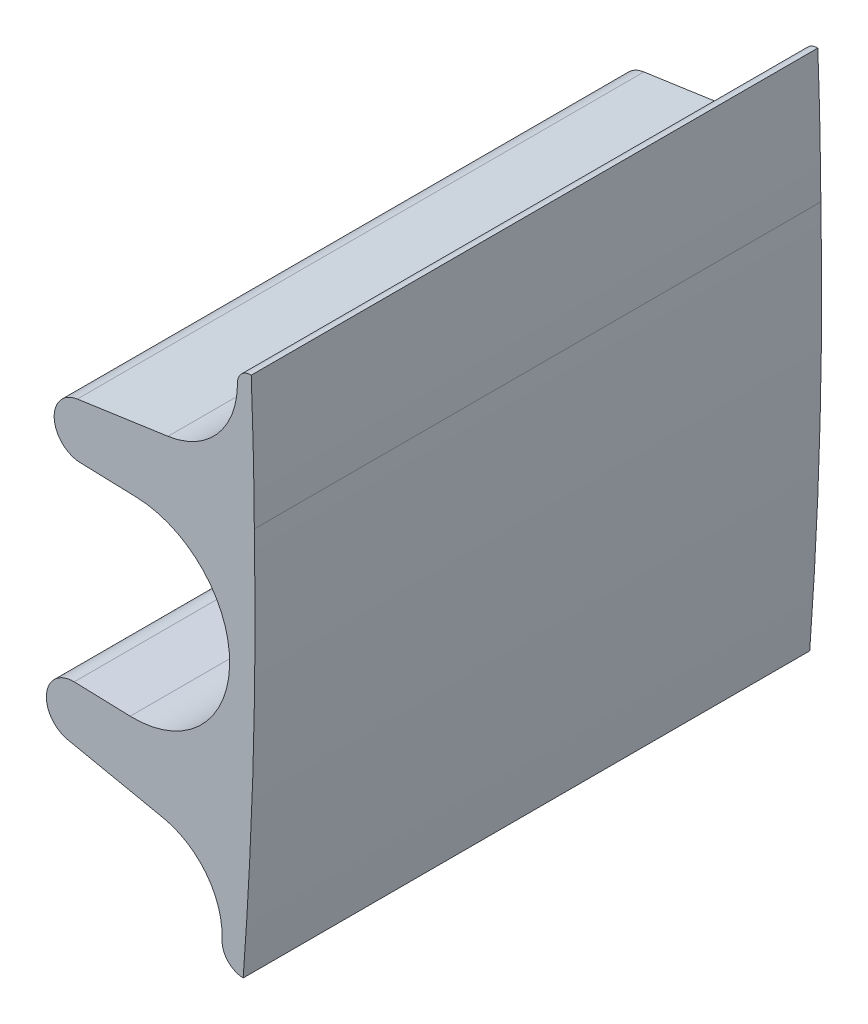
SolidWorks part; units mm, degrees
ref_plane "Plan de face" through (0, 0, 0) normal (0, 0, 1) x (1, 0, 0)
ref_plane "Plan de dessus" through (0, 0, 0) normal (0, 1, 0) x (1, 0, 0)
ref_plane "Plan de droite" through (0, 0, 0) normal (1, 0, 0) x (0, 0, -1)
sketch "Esquisse1" plane through (0, 0, 22.2) normal (0, 0, 1) x (1, 0, 0)
  line L0 (100.5809, 22.6603) -> (98.8108, -33.466) construction
  line L1 (90.1745, 11.994) -> (89.418, -11.994) construction
  line L2 (89.7962, 0) -> (99.8562, -0.3173) construction
  line L3 (85.6517, 11.2559) -> (92.3747, 12.2239)
  line L4 (83.0445, 12.7411) -> (82.4587, -5.8331) construction
  line L5 (89.5708, -7.1464) -> (85.4229, -7.0156)
  line L6 (84.044, 12.7096) -> (83.4582, -5.8646) construction
  line L7 (85.9367, 9.2763) -> (97.9424, 9.9462) construction
  line L8 (85.8737, 7.2773) -> (90.0216, 7.1464)
  line L9 (85.3599, -9.0146) -> (97.5096, -10.4648) construction
  line L10 (84.9507, -10.9723) -> (92.01, -12.4479)
  line L11 (97.6632, 22.6212) -> (96.4767, -15.0006) construction
  line L12 (90.8416, -19.5427) -> (101.6226, -19.8827) construction
  line L13 (93.7751, 19.3842) -> (104.5196, 19.0454) construction
  line L14 (98.5136, 18.2464) -> (98.5656, 19.8956) construction
  line L15 (97.5262, 18.2775) -> (97.5166, 17.9735)
  line L16 (97.9986, -18.1472) -> (97.9476, -19.7668) construction
  line L17 (96.382, -18.0049) -> (96.3791, -18.0961)
  arc A0 (93.4921, -11.4167) -> (87.0968, 11.6924) centre (89.7962, 0) ccw construction
  arc A1 (85.7612, -5.9027) -> (85.6383, -5.8167) centre (89.7962, 0) ccw construction
  arc A2 (89.5708, -7.1464) -> (90.0216, 7.1464) centre (89.7962, 0) ccw
  arc A3 (85.6517, 11.2559) -> (85.8737, 7.2773) centre (85.9367, 9.2763) ccw
  arc A4 (85.4229, -7.0156) -> (84.9507, -10.9723) centre (85.3599, -9.0146) ccw
  arc A5 (92.3747, 12.2239) -> (97.5166, 17.9735) centre (91.5196, 18.1626) ccw
  arc A6 (98.5447, 19.2338) -> (97.5262, 18.2775) centre (98.5136, 18.2464) ccw
  arc A7 (96.382, -18.0049) -> (92.01, -12.4479) centre (90.8847, -17.8316) ccw
  arc A8 (96.3791, -18.0961) -> (97.9476, -19.7668) centre (97.9986, -18.1472) ccw
  spline S0 degree 3 poles (45.0889, -203.3525) (78.8375, -132.8381) (101.1087, -58.3676) (99.7734, 9.4892) knots 0 0 0 0 1 1 1 1 construction
  spline S5 degree 3 poles (-1523.8995, -1118.3395) (-8.8803, -446.6828) (140.7725, -157.8905) (25.9108, 386.013) (-380.0031, 603.4365) (1484.801, 1449.7342) knots -4.803012 -4.803012 -4.803012 -4.803012 0.5 0.5 7.431861 7.431861 7.431861 7.431861 only from (98.7734, 9.4819) to (72.5655, 143.3925)
  spline S6 degree 3 poles (98.7735, 9.4757) (98.7497, 12.7427) (98.6726, 15.9951) (98.5447, 19.2338) knots -0.000044 -0.000044 -0.000044 -0.000044 0.069622 0.069622 0.069622 0.069622
  spline S7 degree 3 poles (1017.5257, 1528.9347) (-972.0485, -1126.3774) (-44.8972, -579.2317) (171.3603, 228.1602) (-99.7079, 523.4008) (-1834.3954, -190.6439) knots -6.245628 -6.245628 -6.245628 -6.245628 0.5 0.5 5.017541 5.017541 5.017541 5.017541 only from (44.1869, -202.9208) to (98.7736, 9.4695)
  spline S8 degree 3 poles (97.9476, -19.7668) (98.6762, -9.9037) (98.963, -0.1459) (98.7735, 9.4757) knots 0.857747 0.857747 0.857747 0.857747 1.000031 1.000031 1.000031 1.000031
  point P51 (97.9476, -19.7668)
  dimension "D2" = 1
  dimension "D1" = 10.06
  dimension "D3" = 4
  dimension "D5" = 5
  dimension "D10" = 12
  dimension "D11" = 11
  dimension "D4" = 5
  dimension "D6" = 1
  dimension "D8" = 39
  dimension "D9" = 19.5
  dimension "D7" = 1
extrude "Extrusion1" add sketch "Esquisse1" along normal mid plane 42
